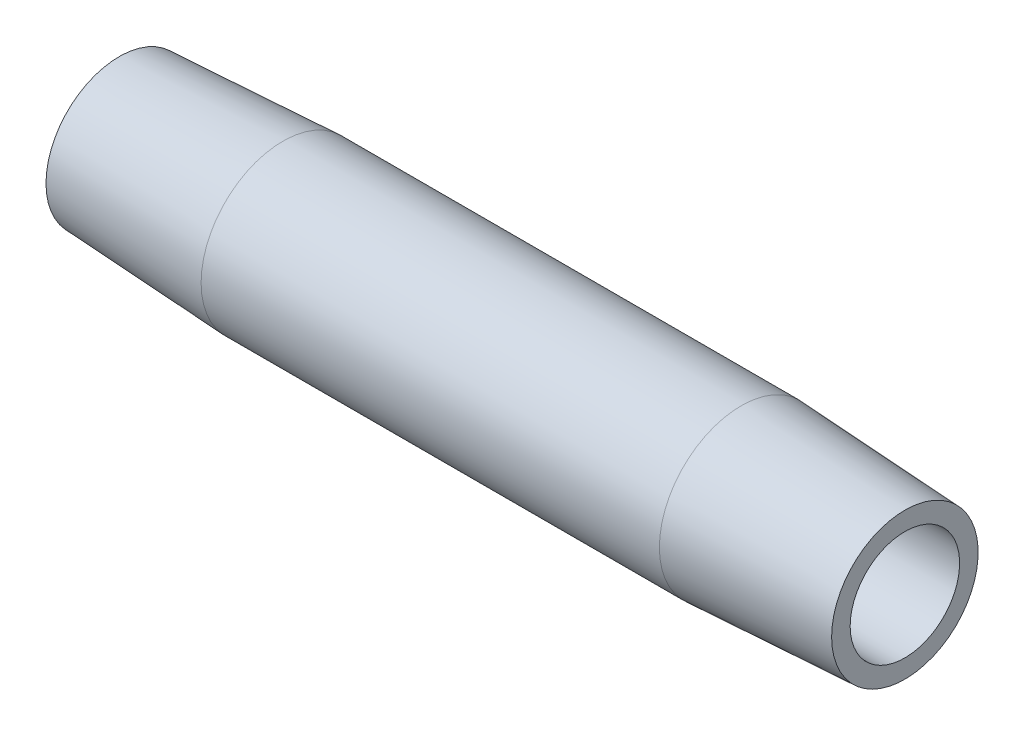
SolidWorks part; units mm, degrees
ref_plane "Front Plane" through (0, 0, 0) normal (0, 0, 1) x (1, 0, 0)
ref_plane "Top Plane" through (0, 0, 0) normal (0, 1, 0) x (1, 0, 0)
ref_plane "Right Plane" through (0, 0, 0) normal (1, 0, 0) x (0, 0, -1)
sketch "Sketch2" plane through (0, 0, 0) normal (0, 0, 1) x (1, 0, 0)
  line L0 (0.4761, 0) -> (50000.4761, 0) construction
  line L1 (0, -11.3625) -> (0, 49988.6375) construction
  line L7 (7.9375, 3.9687) -> (0, 3.5528)
  line L8 (30.1625, 3.9687) -> (7.9375, 3.9687)
  line L9 (38.1, 3.5528) -> (30.1625, 3.9687)
  line L10 (38.1, 2.6543) -> (38.1, 3.5528)
  line L11 (38.1, 2.6543) -> (0, 2.6543)
  line L12 (0, 3.5528) -> (0, 2.6543)
  dimension "D1" = 5.3086
  dimension "D2" = 7.9375
  dimension "D3" = 3
  dimension "D4" = 3
  dimension "D5" = 7.9375
  dimension "D6" = 7.9375
  dimension "D7" = 38.1
revolve "Revolve1" add sketch "Sketch2" angle 360 about L0
